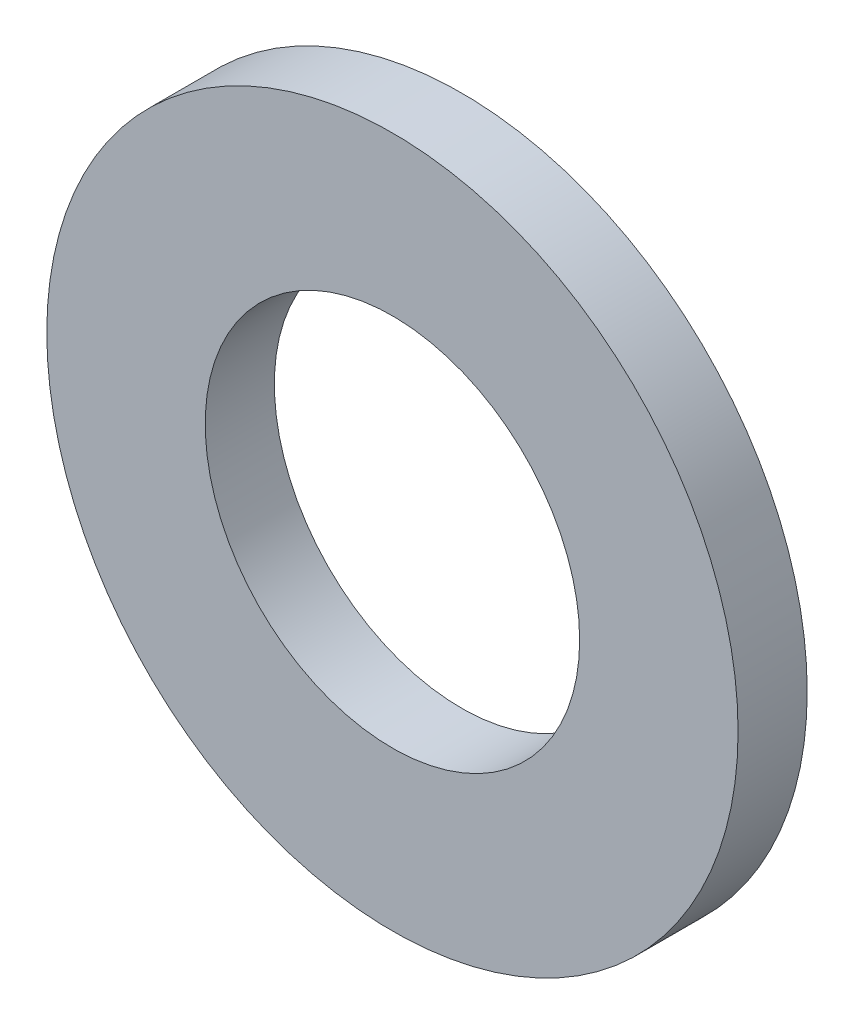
SolidWorks part; units mm, degrees
ref_plane "Plan de face" through (0, 0, 0) normal (0, 0, 1) x (1, 0, 0)
ref_plane "Plan de dessus" through (0, 0, 0) normal (0, 1, 0) x (1, 0, 0)
ref_plane "Plan de droite" through (0, 0, 0) normal (1, 0, 0) x (0, 0, -1)
sketch "Esquisse1" plane through (0, 0, 0) normal (0, 0, 1) x (1, 0, 0)
  circle A0 centre (0, 0) radius 3.25
  circle A1 centre (0, 0) radius 6
  dimension "D1" = 6.5
  dimension "D2" = 12
extrude "Extrusion1" add sketch "Esquisse1" along normal blind 1.2
